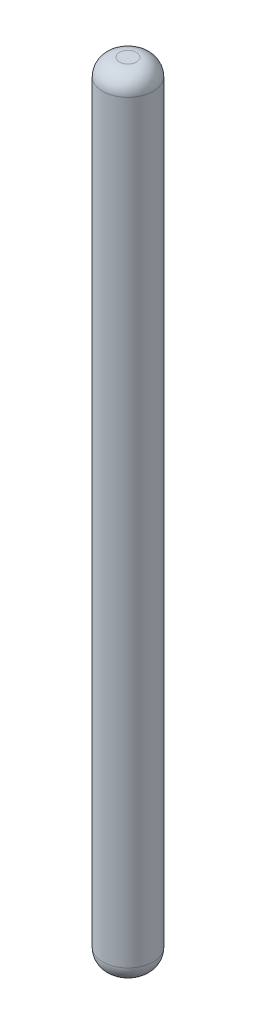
SolidWorks part; units mm, degrees
ref_plane "Front Plane" through (0, 0, 0) normal (0, 0, 1) x (1, 0, 0)
ref_plane "Top Plane" through (0, 0, 0) normal (0, 1, 0) x (1, 0, 0)
ref_plane "Right Plane" through (0, 0, 0) normal (1, 0, 0) x (0, 0, -1)
sketch "Sketch1" plane through (0, 0, 0) normal (0, 1, 0) x (1, 0, 0)
  circle A0 centre (0, 0) radius 4.5
extrude "Boss-Extrude1" add sketch "Sketch1" along normal blind 140
fillet "Fillet1" radius 3 2 edges at (0, 0, 4.5) (0, 140, 4.5)
equation "\"AxisDiameter\"= 9mm'Diameter of the axis"
equation "\"D1@Sketch1\"=\"AxisDiameter\""
equation "\"D1@Boss-Extrude1\"=\"AxisHeight\""
equation "\"AxisHeight\"= 140mm'Axis height"
